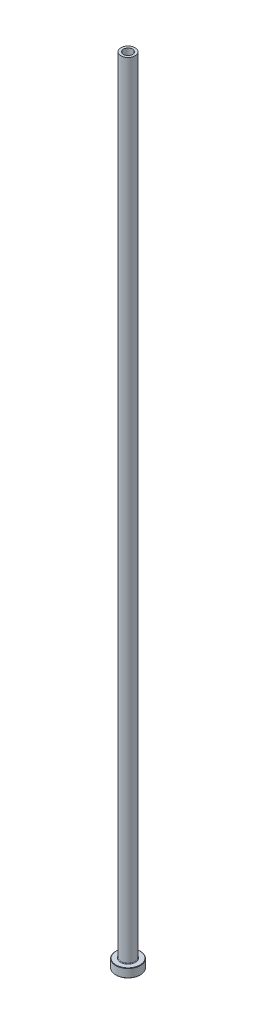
SolidWorks part; units mm, degrees
ref_plane "Front Plane" through (0, 0, 0) normal (0, 0, 1) x (1, 0, 0)
ref_plane "Top Plane" through (0, 0, 0) normal (0, 1, 0) x (1, 0, 0)
ref_plane "Right Plane" through (0, 0, 0) normal (1, 0, 0) x (0, 0, -1)
sketch "Sketch1" plane through (0, 0, 0) normal (0, 0, 1) x (1, 0, 0)
  line L0 (-2.6, 450) -> (-4, 450)
  line L1 (-4, 450) -> (-4, 5)
  line L2 (-4, 5) -> (-7, 5)
  line L3 (-7, 5) -> (-7, 0)
  line L4 (7.7, 0) -> (-7.7, 0) construction
  line L5 (-7, 0) -> (-2.85, 0)
  line L6 (-2.6, 405) -> (-2.6, 450)
  line L7 (0, 92.1877) -> (0, -15.5353) construction
  line L8 (0, -7.7) -> (0, 7.7) construction
  line L9 (-2.6, 405) -> (-2.85, 393)
  line L10 (-2.85, 393) -> (-2.85, 0)
  dimension "D1" = 0.25
  dimension "ID" = 5.2
  dimension "OD" = 8
  dimension "L" = 450
  dimension "H" = 14
  dimension "T" = 5
  dimension "N" = 45
  dimension "D2" = 12
revolve "Revolve1" add sketch "Sketch1" angle 360 about L7
fillet "Fillet1" radius 0.3 1 edges at (0, 5, 4)
chamfer "Chamfer1" distance 0.2 angle 45 2 edges at (0, 5, 7) (0, 0, 7)
chamfer "Chamfer3" distance 0.5 angle 45 1 edges at (0, 0, 2.85)
